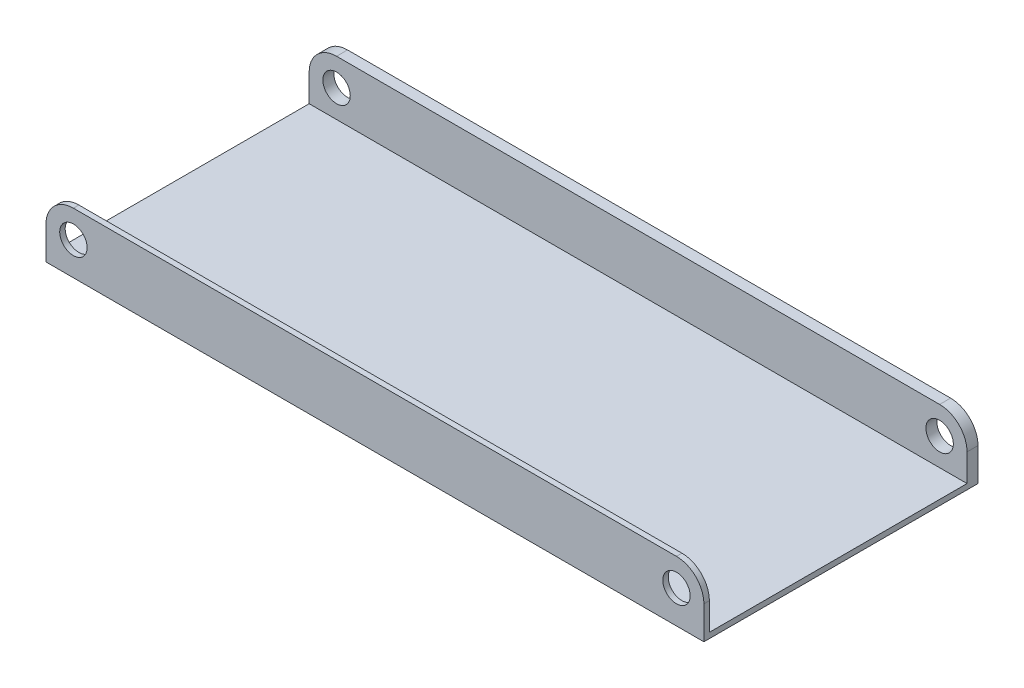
SolidWorks part; units mm, degrees
ref_plane "Front Plane" through (0, 0, 0) normal (0, 0, 1) x (1, 0, 0)
ref_plane "Top Plane" through (0, 0, 0) normal (0, 1, 0) x (1, 0, 0)
ref_plane "Right Plane" through (0, 0, 0) normal (1, 0, 0) x (0, 0, -1)
sketch "Sketch1" plane through (0, 0, 0) normal (0, 1, 0) x (1, 0, 0)
  line L1 (0, 0) -> (152.4, 0)
  line L2 (0, 0) -> (0, -63.5)
  line L3 (0, -63.5) -> (152.4, -63.5)
  line L4 (152.4, 0) -> (152.4, -63.5)
  dimension "D1" = 63.5
  dimension "D2" = 152.4
extrude "Boss-Extrude1" add sketch "Sketch1" along normal blind 1.27
sketch "Sketch2" plane through (0, 1.27, 0) normal (0, 1, 0) x (1, 0, 0)
  line L0 (152.4, -63.5) -> (152.4, 0) construction
  line L1 (0, -63.5) -> (152.4, -63.5)
  line L2 (0, -63.5) -> (0, -62.23)
  line L3 (0, -62.23) -> (152.4, -62.23)
  line L4 (152.4, -63.5) -> (152.4, -62.23)
  line L6 (0, 0) -> (152.4, 0)
  line L7 (0, 0) -> (0, -2.54)
  line L8 (0, -2.54) -> (152.4, -2.54)
  line L9 (152.4, 0) -> (152.4, -2.54)
  point P12 (152.4, -1.27)
  dimension "D1" = 1.27
  dimension "D2" = 1.27
extrude "Boss-Extrude2" add sketch "Sketch2" along normal blind 12.7
sketch "Sketch3" plane through (0, 0, 63.5) normal (0, 0, 1) x (1, 0, 0)
  line L0 (0, 13.97) -> (0, 0) construction
  line L2 (0, 13.97) -> (152.4, 13.97) construction
  line L3 (152.4, 13.97) -> (152.4, 0) construction
  circle A0 centre (6.35, 7.62) radius 3.175
  circle A1 centre (146.05, 7.62) radius 3.175
  dimension "D1" = 6.35
  dimension "D2" = 6.35
  dimension "D3" = 6.35
  dimension "D4" = 6.35
  dimension "D5" = 6.35
  dimension "D6" = 6.35
extrude "Cut-Extrude1" cut sketch "Sketch3" against normal through all
fillet "Fillet1" radius 6.35 4 edges at (152.4, 13.97, 62.865) (152.4, 13.97, 1.27) (0, 13.97, 1.27) (0, 13.97, 62.865)
